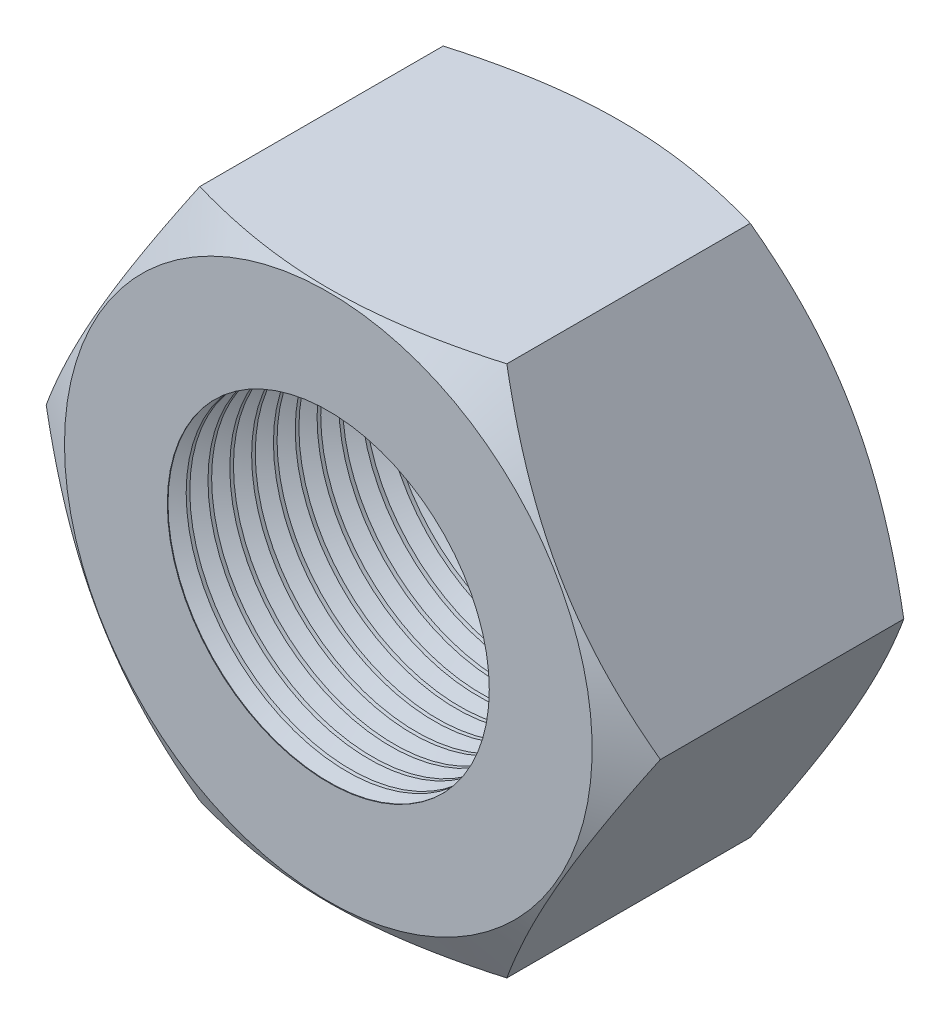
SolidWorks part; units mm, degrees
ref_plane "Front" through (0, 0, 0) normal (0, 0, 1) x (1, 0, 0)
ref_plane "Top" through (0, 0, 0) normal (0, 1, 0) x (1, 0, 0)
ref_plane "Right" through (0, 0, 0) normal (1, 0, 0) x (0, 0, -1)
sketch "Sketch1" plane through (0, 0, 0) normal (0, 0, 1) x (1, 0, 0)
  line L1 (27.4241, -47.5) -> (54.8483, 0)
  line L2 (54.8483, 0) -> (27.4241, 47.5)
  line L3 (27.4241, 47.5) -> (-27.4241, 47.5)
  line L4 (-27.4241, 47.5) -> (-54.8483, 0)
  line L5 (-54.8483, 0) -> (-27.4241, -47.5)
  line L6 (-27.4241, -47.5) -> (27.4241, -47.5)
  circle A0 centre (0, 0) radius 47.5 construction
  circle A1 centre (0, 0) radius 28.7525
  dimension "D" = 57.505
  dimension "s" = 95
extrude "BaseNut" add sketch "Sketch1" against normal blind 52.4
sketch "Sketch2" plane through (0, 0, 0) normal (0, 1, 0) x (1, 0, 0)
  line L0 (-54.8483, 52.4) -> (-47.125, 52.4)
  line L2 (-47.125, 52.4) -> (-54.8483, 47.941)
  line L3 (-54.8483, 47.941) -> (-54.8483, 52.4)
  line L4 (0, 3.3759) -> (0, -9.8171) construction
  line L6 (-9.7712, 26.2) -> (9.8853, 26.2) construction
  line L7 (-54.8483, 4.459) -> (-54.8483, 0)
  line L8 (-47.125, 0) -> (-54.8483, 4.459)
  line L9 (-54.8483, 0) -> (-47.125, 0)
  line L10 (-54.8483, 52.4) -> (-54.8483, 0) construction
  dimension "D1" = 30
  dimension "dw" = 94.25
  dimension "D2" = 26.2
revolve "Double-Chamfer" cut sketch "Sketch2" angle 360 about L4
sketch "Sketch4" plane through (0, 0, 0) normal (0, 1, 0) x (1, 0, 0)
  line L0 (31.5649, 52.4) -> (28.7525, 50.7762)
  line L1 (28.7525, 50.7762) -> (25.505, 50.7762)
  line L2 (25.505, 50.7762) -> (25.505, 54.0237)
  line L3 (25.505, 54.0237) -> (28.7525, 54.0237)
  line L4 (28.7525, 54.0237) -> (31.5649, 52.4)
  line L5 (0, 0) -> (0, 109.7681) construction
  dimension "D1" = 3.2475
  dimension "D2" = 57.505
revolve "Cut-Revolve10" cut sketch "Sketch4" angle 360 about L5
pattern_linear "LPattern10" count 14 spacing 3.897 along (0, 0, 1) of "Cut-Revolve10"
equation "\"dw@Sketch2\" = \"s@Sketch1\"-0.75"
equation "\"D2@Sketch2\" = \"m@BaseNut\" / 2"
equation "\"D2@Sketch4\"=\"D@Sketch1\""
equation "\"D1@Sketch4\" =  (\"D@ThreadCosmetic1\" - \"D2@Sketch4\"  )  / 2"
equation "\"D3@LPattern10\" = \"D1@Sketch4\" * 1.2"
equation "\"D1@LPattern10\" = \"m@BaseNut\" / \"D3@LPattern10\" + 1"
